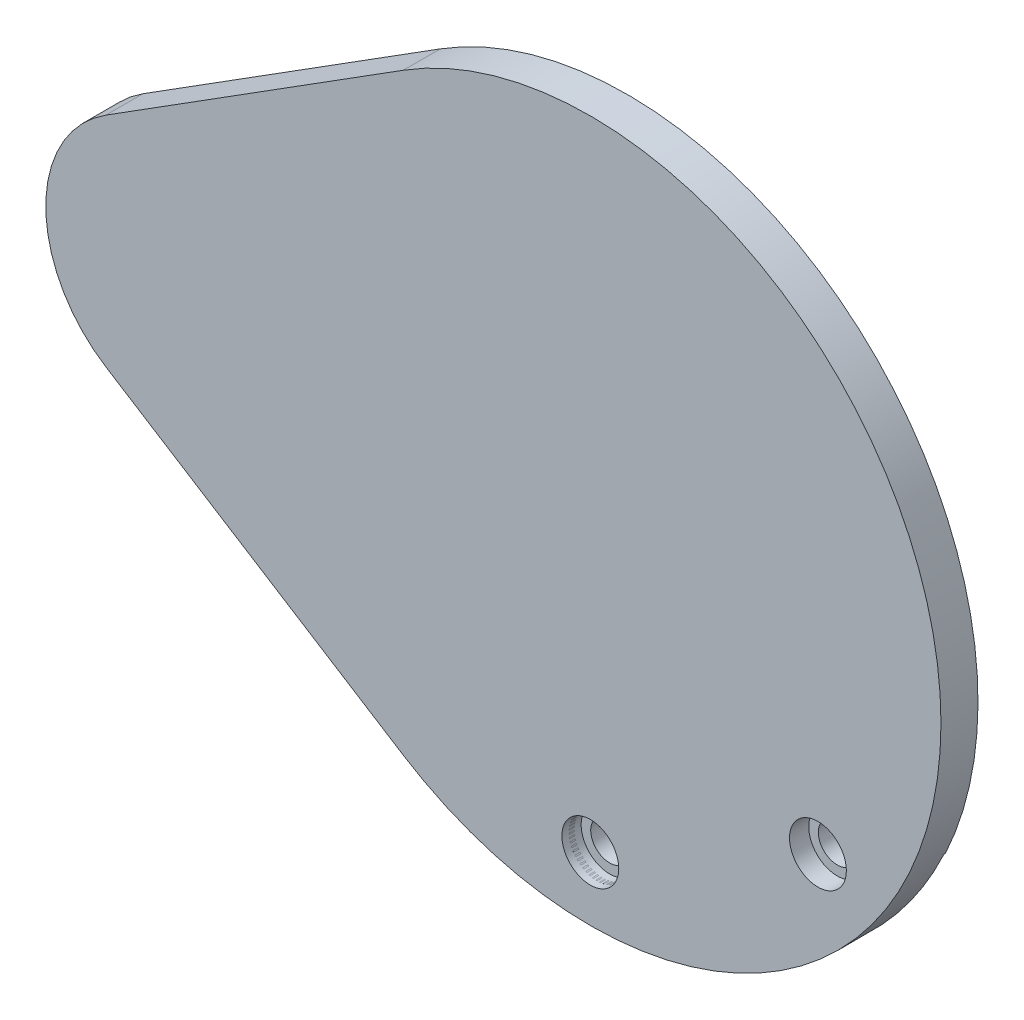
SolidWorks part; units mm, degrees
ref_plane "TOP" through (0, 0, 0) normal (0, 0, 1) x (1, 0, 0)
ref_plane "FRONT" through (0, 0, 0) normal (0, 1, 0) x (1, 0, 0)
ref_plane "SIDE" through (0, 0, 0) normal (1, 0, 0) x (0, 0, -1)
sketch "Sketch1" plane through (0, 0, 0) normal (0, 0, 1) x (1, 0, 0)
  line L0 (-325.6471, 73.3335) -> (-125.7483, 199.3978)
  line L1 (-325.6471, -73.3335) -> (-125.7483, -199.3978)
  arc A0 (-125.7483, -199.3978) -> (-125.7483, 199.3978) centre (0, 0) ccw
  arc A1 (-325.6471, 73.3335) -> (-325.6471, -73.3335) centre (-279.4, 0) ccw
  dimension "D1" = 471.4748
  dimension "D2" = 279.4
extrude "Base-Extrude" add sketch "Sketch1" along normal blind 24.892
sketch "Sketch2" plane through (0, 0, 24.892) normal (0, 0, 1) x (1, 0, 0)
  circle A0 centre (0, -193.04) radius 12.7
  circle A1 centre (153.0086, -117.6979) radius 12.7
  dimension "D4" = 25.4
  dimension "D1" = 193.04
  dimension "D2" = 193.04
  dimension "D3" = 153.0086
sketch "Sketch3" plane through (0, 0, 24.892) normal (0, 0, 1) x (1, 0, 0)
  circle A0 centre (153.0086, -117.6979) radius 19.1135
  circle A1 centre (0, -193.04) radius 19.1135
  dimension "D1" = 38.227
extrude "Cut-Extrude1" cut sketch "Sketch3" against normal blind 12.954
extrude "Cut-Extrude2" cut sketch "Sketch2" against normal through all
sketch "Sketch4" plane through (0, 0, 0) normal (0, 0, -1) x (-1, 0, 0)
  circle A0 centre (0, -193.04) radius 63.5
  circle A1 centre (-153.0086, -117.6979) radius 63.5
  dimension "D1" = 127
extrude "Cut-Extrude3" cut sketch "Sketch4" against normal blind 1.016
ref_plane "Plane6" through (0, 0, 18.415) normal (0, 0, 1) x (1, 0, 0)
ref_plane "Plane8" through (0, -193.675, 0) normal (0, 1, 0) x (-1, 0, 0)
sketch "Sketch12" plane through (0, -193.675, 0) normal (0, 1, 0) x (-1, 0, 0)
  line L0 (-21.209, 20.193) -> (-21.209, 16.637)
  line L1 (-21.209, 16.637) -> (-19.1135, 16.637)
  line L2 (-19.1135, 24.892) -> (-19.1135, 11.938) construction
  line L3 (-19.1135, 16.637) -> (-19.1135, 20.193)
  line L4 (-19.1135, 20.193) -> (-21.209, 20.193)
  line L5 (50, 18.415) -> (-50, 18.415) construction
  dimension "D1" = 21.209
  dimension "D2" = 3.556
  dimension "D3" = 1.778
sketch "Sketch13" plane through (0, 0, 18.415) normal (0, 0, 1) x (1, 0, 0)
  circle A0 centre (0, -193.04) radius 21.209
  dimension "D1" = 42.418
sweep "Cut-Sweep1" cut profiles "Sketch12" path "Sketch13"
